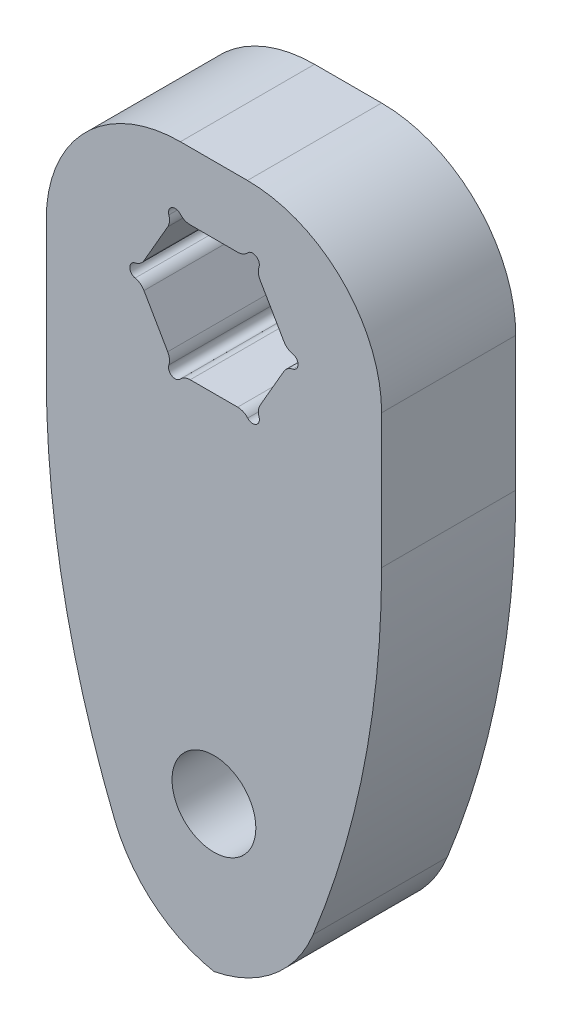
SolidWorks part; units mm, degrees
ref_plane "Front Plane" through (0, 0, 0) normal (0, 0, 1) x (1, 0, 0)
ref_plane "Top Plane" through (0, 0, 0) normal (0, 1, 0) x (1, 0, 0)
ref_plane "Right Plane" through (0, 0, 0) normal (1, 0, 0) x (0, 0, -1)
sketch "Sketch1" plane through (0, 0, 0) normal (0, 0, 1) x (1, 0, 0)
  line L0 (-15.875, -53.975) -> (-15.875, 12.7)
  line L2 (7.3323, 0) -> (3.6662, 6.35)
  line L3 (3.6662, 6.35) -> (-3.6662, 6.35)
  line L4 (-3.6662, 6.35) -> (-7.3323, 0)
  line L5 (-7.3323, 0) -> (-3.6662, -6.35)
  line L6 (-3.6662, -6.35) -> (3.6662, -6.35)
  line L7 (-15.875, 12.7) -> (15.875, 12.7)
  line L8 (15.875, 12.7) -> (15.875, -53.975)
  line L9 (15.875, -53.975) -> (-15.875, -53.975)
  line L10 (0, 23.2184) -> (0, -60.9838) construction
  line L11 (3.6662, -6.35) -> (7.3323, 0)
  circle A0 centre (0, 0) radius 6.35 construction
  point P2 (0, 6.35)
  point P11 (0, 12.7)
  dimension "D1" = 12.7
  dimension "D3" = 12.7
  dimension "D2" = 31.75
  dimension "D4" = 53.975
extrude "Boss-Extrude1" add sketch "Sketch1" along normal blind 12.7
hole_wizard "5/16 (0.3125) Diameter Hole1" positions "Sketch3" profile "Sketch2" hole size "5/16" standard "ANSI Inch"
sketch "Sketch3" plane through (0, 0, 12.7) normal (0, 0, 1) x (1, 0, 0)
  point P0 (0, -40.0007)
  dimension "D1" = 40.0007
sketch "Sketch2" plane through (0, -40.0007, 12.7) normal (1, 0, 0) x (0, -1, 0)
  line L0 (0, 0) -> (0, 12.7)
  line L1 (0, 12.7) -> (3.9687, 12.7)
  line L2 (3.9687, 12.7) -> (3.9688, 0)
  line L5 (3.9688, 0) -> (0, 0)
  line L11 (0, -6.35) -> (0, 107.95) construction
  dimension "Thru Hole Dia." = 7.9375
  dimension "Thru Hole Depth" = 12.7
sketch "Sketch4" plane through (0, 0, 12.7) normal (0, 0, 1) x (1, 0, 0)
  circle A0 centre (-3.6662, 6.35) radius 0.635
  circle A1 centre (3.6662, 6.35) radius 0.635
  circle A2 centre (7.3323, 0) radius 0.635
  circle A3 centre (3.6662, -6.35) radius 0.635
  circle A4 centre (-3.6662, -6.35) radius 0.635
  circle A5 centre (-7.3323, 0) radius 0.635
  dimension "D1" = 1.27
extrude "Cut-Extrude1" cut sketch "Sketch4" against normal through all
fillet "Fillet2" radius 1.27 12 edges at (-3.0312, 6.35, 6.35) (3.0312, 6.35, 6.35) (3.9837, 5.8001, 6.35) (7.0148, 0.5499, 6.35) (7.0148, -0.5499, 6.35) (3.9837, -5.8001, 6.35) (3.0312, -6.35, 6.35) (-3.0312, -6.35, 6.35) (-3.9837, -5.8001, 6.35) (-7.0148, -0.5499, 6.35) (-7.0148, 0.5499, 6.35) (-3.9837, 5.8001, 6.35)
sketch "Sketch5" plane through (0, 0, 12.7) normal (0, 0, 1) x (1, 0, 0)
  line L0 (-15.875, 12.7) -> (-15.875, -12.7)
  line L1 (-15.875, 12.7) -> (-15.875, -53.975) construction
  line L2 (-15.875, -53.975) -> (15.875, -53.975) construction
  line L3 (0, 0) -> (0, -53.975) construction
  line L4 (-15.875, -12.7) -> (-15.875, -53.975)
  line L5 (-15.875, -53.975) -> (-5.7124, -53.975)
  line L6 (15.875, -53.975) -> (5.7124, -53.975)
  line L7 (15.875, -12.7) -> (15.875, -53.975)
  arc A0 (-15.875, -12.7) -> (-5.7124, -53.975) centre (73.025, -12.7) ccw
  arc A1 (15.875, -12.7) -> (5.7124, -53.975) centre (-73.025, -12.7) cw
  dimension "D2" = 88.9
  dimension "D1" = 25.4
extrude "Cut-Extrude2" cut sketch "Sketch5" against normal through all contours A1 M4 M3 | A0 M6 M3
fillet "Fillet3" radius 12.7 4 edges at (-5.7124, -53.975, 6.35) (5.7124, -53.975, 6.35) (15.875, 12.7, 6.35) (-15.875, 12.7, 6.35)
